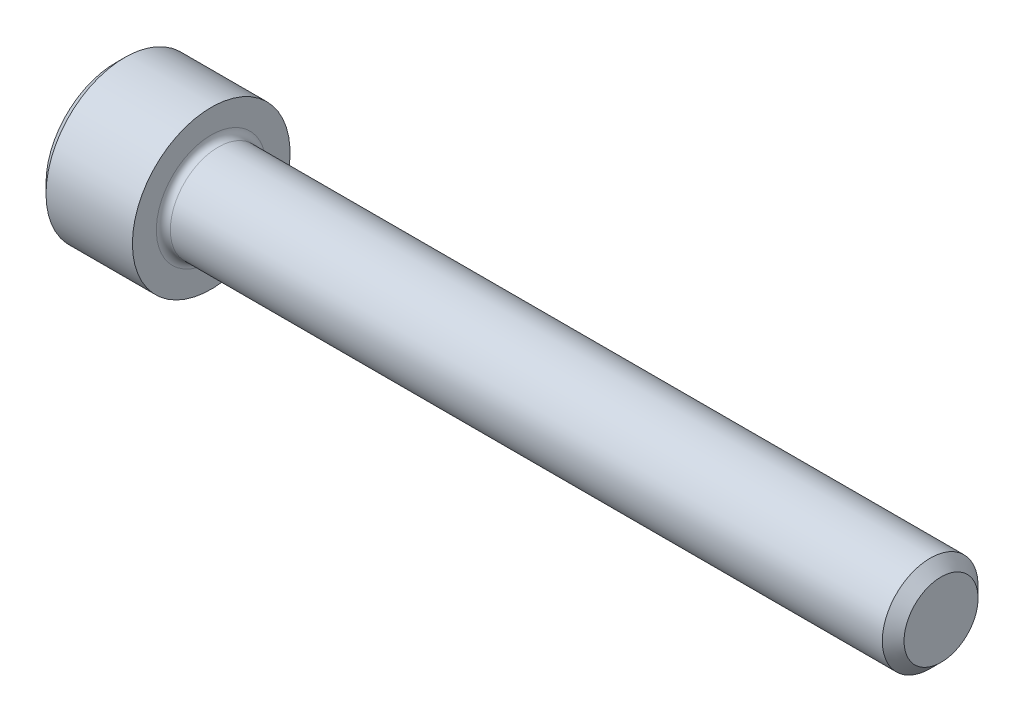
SolidWorks part; units mm, degrees
revolve "Base-Revolve" add sketch "BodySke"
sketch "BodySke" plane through (0, 0, 0) normal (0, 0, 1) x (1, 0, 0)
  line L0 (0, 0) -> (0, 3.0226)
  line L1 (0.4064, 3.429) -> (4.1656, 3.429)
  line L2 (4.1656, 3.429) -> (4.1656, 2.0828)
  line L3 (4.1656, 2.0828) -> (35.4432, 2.0828)
  line L4 (35.9156, 1.6104) -> (35.9156, 0)
  line L5 (35.9156, 0) -> (0, 0)
  line L6 (-31.75, 0) -> (127, 0) construction
  line L7 (0, 3.0226) -> (0.4064, 3.429)
  line L8 (35.9156, 1.6104) -> (35.4432, 2.0828)
  line L9 (0, -3.0226) -> (0.4064, -3.429) construction
  line L10 (35.9156, -1.6104) -> (35.4432, -2.0828) construction
  line L11 (4.9581, 9.525) -> (4.9581, 3.175) construction
  line L12 (13.6906, 9.525) -> (13.6906, 3.175) construction
  line L13 (-2.1844, 9.525) -> (-2.1844, 3.175) construction
  dimension "Diameter" = 4.1656
  dimension "Head_ht" = 4.1656
  dimension "Length" = 31.75
  dimension "Body_ch_ang" = 45
  dimension "Head_dia" = 6.858
  dimension "Head_ch_ang" = 45
  dimension "Head_side_ht" = 3.7592
  dimension "Minor_dia" = 3.2207
  dimension "Advance" = 0.7925
  dimension "Thread_nom" = 22.225
  dimension "Thread_length" = 38.1
fillet "Fillet1" radius 0.3048 1 edges at (4.1656, 0, 2.0828)
ref_plane "Plane1" through (0, 0, 0) normal (0, 0, 1) x (1, 0, 0)
ref_plane "Plane2" through (0, 0, 0) normal (0, 1, 0) x (1, 0, 0)
ref_plane "Plane3" through (0, 0, 0) normal (1, 0, 0) x (0, 0, -1)
sketch "Sketch2" plane through (0, 0, 0) normal (0, 0, 1) x (1, 0, 0)
  line L0 (0, 1.778) -> (1.9558, 1.778)
  line L1 (1.9558, 1.778) -> (2.9823, 0)
  line L2 (-31.75, 0) -> (127, 0) construction
  line L3 (2.9823, 0) -> (0, 0)
  line L4 (0, 0) -> (0, 1.778)
  line L5 (0, 3.0226) -> (0, -3.0226) construction
  line L6 (0, 0) -> (47.625, 0) construction
  line L7 (4.1656, -3.429) -> (4.1656, 3.429) construction
revolve "Hex-PreBroach" cut sketch "Sketch2" angle 360 about L6
sketch "Sketch3" plane through (0, 0, 0) normal (-1, 0, 0) x (0, 0.5, 0.866)
  line L0 (1.0265, 1.778) -> (-1.0265, 1.778)
  line L1 (-1.0265, 1.778) -> (-2.0531, 0)
  line L2 (1.0265, 1.778) -> (2.0531, 0)
  line L3 (1.0265, -1.778) -> (2.0531, 0)
  line L4 (1.0265, -1.778) -> (-1.0265, -1.778)
  line L5 (-1.0265, -1.778) -> (-2.0531, 0)
extrude "Hex" cut sketch "Sketch3" against normal blind 1.9558
sketch "Sketch4" plane through (0, 0, 0) normal (-1, 0, 0) x (0, 0, 1)
  line L0 (0, 0) -> (2.1971, 0)
  line L1 (0, 0) -> (6.1484, 3.5498) construction
  line L2 (0, 0) -> (1.0985, 1.9027)
  line L3 (1.8302, 0.5287) -> (2.0897, 0.6786)
  line L4 (1.373, 1.3206) -> (1.6325, 1.4704)
  arc A0 (1.8302, 0.5287) -> (1.373, 1.3206) centre (0, 0) ccw
  arc A1 (2.1971, 0) -> (2.0897, 0.6786) centre (0, 0) ccw
  arc A2 (1.0985, 1.9027) -> (1.6325, 1.4704) centre (0, 0) cw
extrude "Spline" [suppressed] cut sketch "Sketch4" against normal blind 1.9558
pattern_circular "CirPattern1" [suppressed] count 6 every 60
sketch "Sketch5" plane through (0, 0, 0) normal (0, 0, 1) x (1, 0, 0)
  line L0 (-31.75, 0) -> (127, 0) construction
  line L2 (0, 3.0226) -> (0, -3.0226) construction
  circle A0 centre (1.524, 0) radius 0.5905
  dimension "Drilled_hole_dia" = 1.1811
  dimension "Drilled_hole_loc" = 1.524
extrude "Hole" [suppressed] cut sketch "Sketch5" against normal through all and the other way through all
pattern_circular "Drilled-4" [suppressed] count 2 every 60
pattern_circular "Drilled-6" [suppressed] count 3 every 60
sketch "ThdSchSke" plane through (0, 0, 0) normal (0, 0, 1) x (1, 0, 0)
  line L0 (13.6906, -1.6104) -> (13.3598, -2.0828)
  line L1 (13.6906, -1.6104) -> (14.0214, -2.0828)
  line L2 (14.0214, -2.0828) -> (14.0214, -2.6035)
  line L3 (-3.175, 0) -> (5.1513, 0) construction
  line L5 (14.0214, -2.6035) -> (13.3598, -2.6035)
  line L6 (13.3598, -2.6035) -> (13.3598, -2.0828)
  line L7 (0, 3.0226) -> (0, -3.0226) construction
revolve "ThreadSchematic" [suppressed] cut sketch "ThdSchSke" angle 360 about L3
pattern_linear "ThdSchPat" [suppressed]
equation "\"D2@Sketch3\" = \"Hex_size@Sketch3\" / 2"
equation "\"D1@Sketch3\" = \"Hex_size@Sketch3\" / 2"
equation "\"D1@Sketch2\" = \"Hex_size@Sketch3\" / 2"
equation "\"D3@Sketch4\" = \"Spline_p_dim@Sketch4\" / 2"
equation "\"Thread_minor@ThreadCosmetic\"  =  \"Minor_dia@BodySke\""
equation "\"D2@CirPattern1\" = 360 / \"Num_teeth@CirPattern1\""
equation "\"Wall_thickness@Sketch2\" = \"Head_ht@BodySke\" - \"Key_eng@Hex\""
equation "\"Thread_length@ThreadCosmetic\" = ((sgn( (\"Length@BodySke\" - \"Advance@BodySke\" ) - \"Thread_nom@BodySke\" )-1)*( (\"Length@BodySke\" - \"Advance@BodySke\" ) - \"Thread_nom@BodySke\" ))/-2+ \"Thread_nom@BodySke\""
equation "\"Thread_minor@ThdSchSke\" = \"Minor_dia@BodySke\""
equation "\"Diameter@ThdSchSke\" = \"Diameter@BodySke\""
equation "\"Overcut@ThdSchSke\" = \"Diameter@BodySke\" * 1.25"
equation "\"Start@ThdSchSke\" = \"Head_ht@BodySke\" + \"Length@BodySke\" - \"Thread_length@ThreadCosmetic\"  '---Non-countersunk---"
equation "\"Num_threads@ThdSchPat\" = int( \"Thread_length@ThreadCosmetic\" / \"Advance@BodySke\" + 0.999 )  + 1"
equation "\"Advance@ThdSchPat\" = \"Thread_length@ThreadCosmetic\" /  (\"Num_threads@ThdSchPat\" - 1) 'relax it"
equation "\"Num_threads@ThdSchPat\" = \"Num_threads@ThdSchPat\" - sgn( \"Num_threads@ThdSchPat\" - 1) '---chamfered tips only---"
